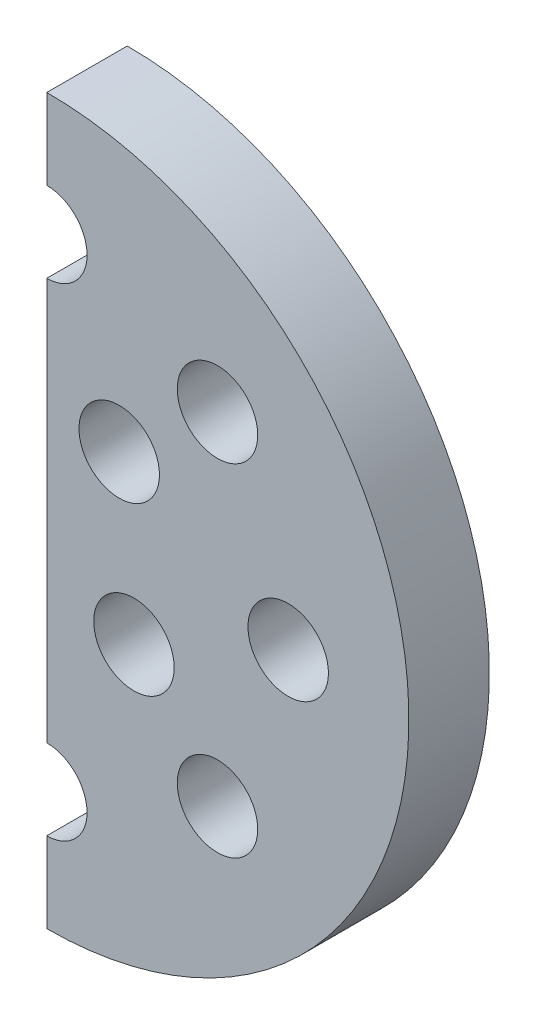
SolidWorks part; units mm, degrees
ref_plane "Front Plane" through (0, 0, 0) normal (0, 0, 1) x (1, 0, 0)
ref_plane "Top Plane" through (0, 0, 0) normal (0, 1, 0) x (1, 0, 0)
ref_plane "Right Plane" through (0, 0, 0) normal (1, 0, 0) x (0, 0, -1)
sketch "Sketch1" plane through (0, 0, 0) normal (0, 0, 1) x (1, 0, 0)
  circle A0 centre (0, 0) radius 275
  circle A1 centre (0, 150) radius 25
  circle A2 centre (106.066, 106.066) radius 25
  circle A3 centre (150, 0) radius 25
  circle A4 centre (106.066, -106.066) radius 25
  circle A5 centre (0, -150) radius 25
  circle A6 centre (-106.066, -106.066) radius 25
  circle A7 centre (-150, 0) radius 25
  circle A8 centre (-106.066, 106.066) radius 25
  circle A9 centre (-54.151, 45) radius 25
  circle A10 centre (45, 54.151) radius 25
  circle A11 centre (54.151, -45) radius 25
  circle A12 centre (-45, -54.151) radius 25
  point P22 (0, 0)
  point P31 (0, 0)
  dimension "D1" = 550
  dimension "D3" = 50
  dimension "D6" = 50
  dimension "D2" = 150
  dimension "D5" = 45
  dimension "D4" = 8
  dimension "D7" = 4
extrude "Boss-Extrude1" add sketch "Sketch1" along normal blind 50
fillet "Fillet1" radius 10 1 edges at (275, 0, 50)
fillet "Fillet2" radius 10 1 edges at (275, 0, 0)
sketch "Sketch2" plane through (0, 0, 0) normal (0, 0, 1) x (1, 0, 0)
  circle A0 centre (0, 0) radius 225
  circle A1 centre (0, 0) radius 320.2121
  dimension "D1" = 450
extrude "Cut-Extrude2" cut sketch "Sketch2" against normal blind 100 and the other way through all
sketch "Sketch3" plane through (0, 0, 0) normal (0, 0, 1) x (1, 0, 0)
  line L0 (0, 225) -> (0, -225)
  arc A0 (0, 225) -> (0, -225) centre (0, 0) ccw
extrude "Cut-Extrude3" cut sketch "Sketch3" along normal blind 100
